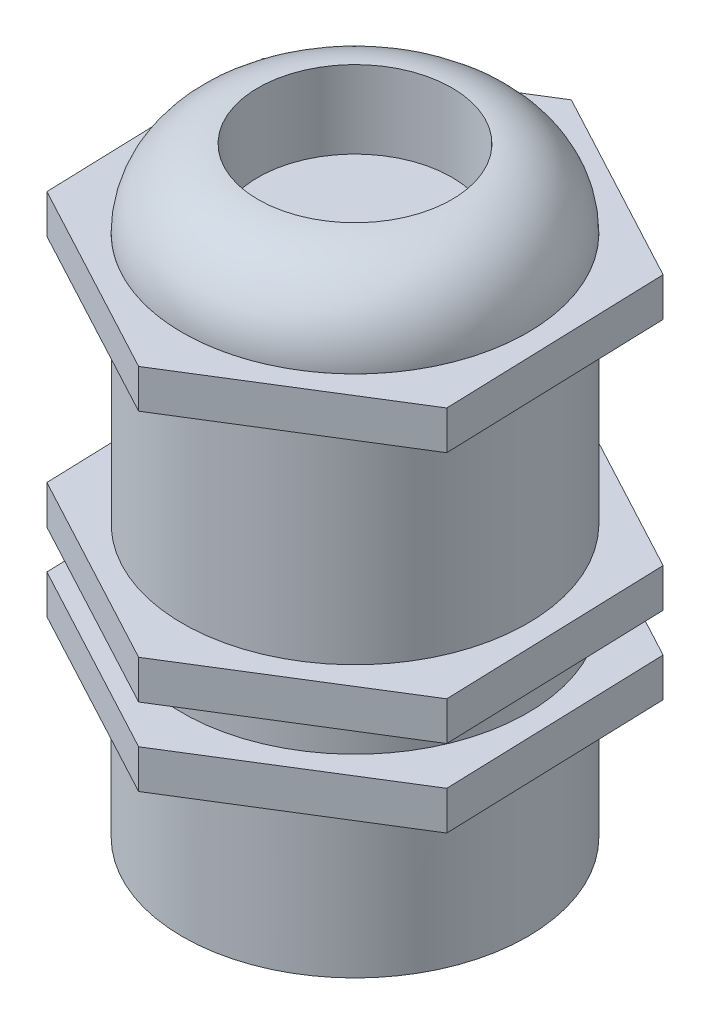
SolidWorks part; units mm, degrees
ref_plane "前视基准面" through (0, 0, 0) normal (0, 0, 1) x (1, 0, 0)
ref_plane "上视基准面" through (0, 0, 0) normal (0, 1, 0) x (1, 0, 0)
ref_plane "右视基准面" through (0, 0, 0) normal (1, 0, 0) x (0, 0, -1)
sketch "草图1" plane through (0, 0, 0) normal (0, 1, 0) x (1, 0, 0)
  circle A0 centre (0, 0) radius 8.9
  dimension "D1" = 17.8
extrude "凸台-拉伸1" add sketch "草图1" along normal blind 31
sketch "草图2" plane through (0, 31, 0) normal (0, 1, 0) x (1, 0, 0)
  circle A0 centre (0, 0) radius 5
  dimension "D1" = 10
extrude "切除-拉伸1" cut sketch "草图2" against normal through all
fillet "圆角1" radius 4 1 edges at (0, 31, 8.9)
ref_plane "基准面1" through (0, 27, 0) normal (0, -1, 0) x (-1, 0, 0)
sketch "草图3" plane through (0, 27, 0) normal (0, -1, 0) x (-1, 0, 0)
  line L1 (0.3742, 11.5409) -> (-9.8076, 6.0946)
  line L2 (-9.8076, 6.0946) -> (-10.1819, -5.4464)
  line L3 (-10.1819, -5.4464) -> (-0.3742, -11.5409)
  line L4 (-0.3742, -11.5409) -> (9.8076, -6.0946)
  line L5 (9.8076, -6.0946) -> (10.1819, 5.4464)
  line L6 (10.1819, 5.4464) -> (0.3742, 11.5409)
  circle A0 centre (0, 0) radius 10 construction
extrude "凸台-拉伸2" add sketch "草图3" along normal blind 2
pattern_linear "阵列(线性)1" count 2 spacing 13 along (0, -1, 0) of "凸台-拉伸2"
pattern_linear "阵列(线性)2" count 2 spacing 17 along (0, -1, 0) of "凸台-拉伸2"
